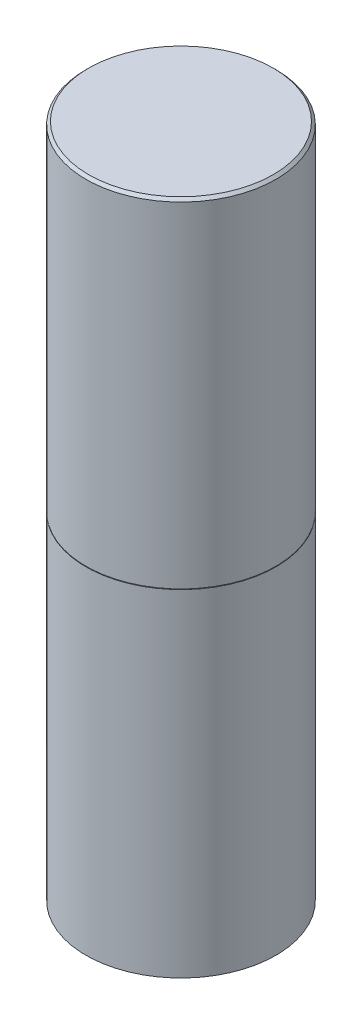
SolidWorks part; units mm, degrees
ref_plane "Front" through (0, 0, 0) normal (0, 0, 1) x (1, 0, 0)
ref_plane "Top" through (0, 0, 0) normal (0, 1, 0) x (1, 0, 0)
ref_plane "Right" through (0, 0, 0) normal (1, 0, 0) x (0, 0, -1)
sketch "Sketch1" plane through (0, 0, 0) normal (1, 0, 0) x (0, 0, -1)
  line L0 (0, 0) -> (0, 124.25)
  line L1 (0, 124.25) -> (-17.5, 124.25)
  line L2 (-17.5, 124.25) -> (-17.5, 62.05)
  line L3 (-17.5, 0) -> (0, 0)
  line L4 (-17.5, 62.05) -> (-17.4134, 62)
  line L5 (-17.4134, 62) -> (-17.5, 61.95)
  line L6 (-17.5, 61.95) -> (-17.5, 0)
  line L7 (-17.5, 62.05) -> (-17.5, 61.95) construction
  dimension "D1" = 62
  dimension "D2" = 0.1
  dimension "D3" = 17.5
  dimension "D4" = 124.25
revolve "Revolve1" add sketch "Sketch1" angle 360 about L0
chamfer "Chamfer1" distance 0.5 angle 45 1 edges at (0, 124.25, -17.5)
